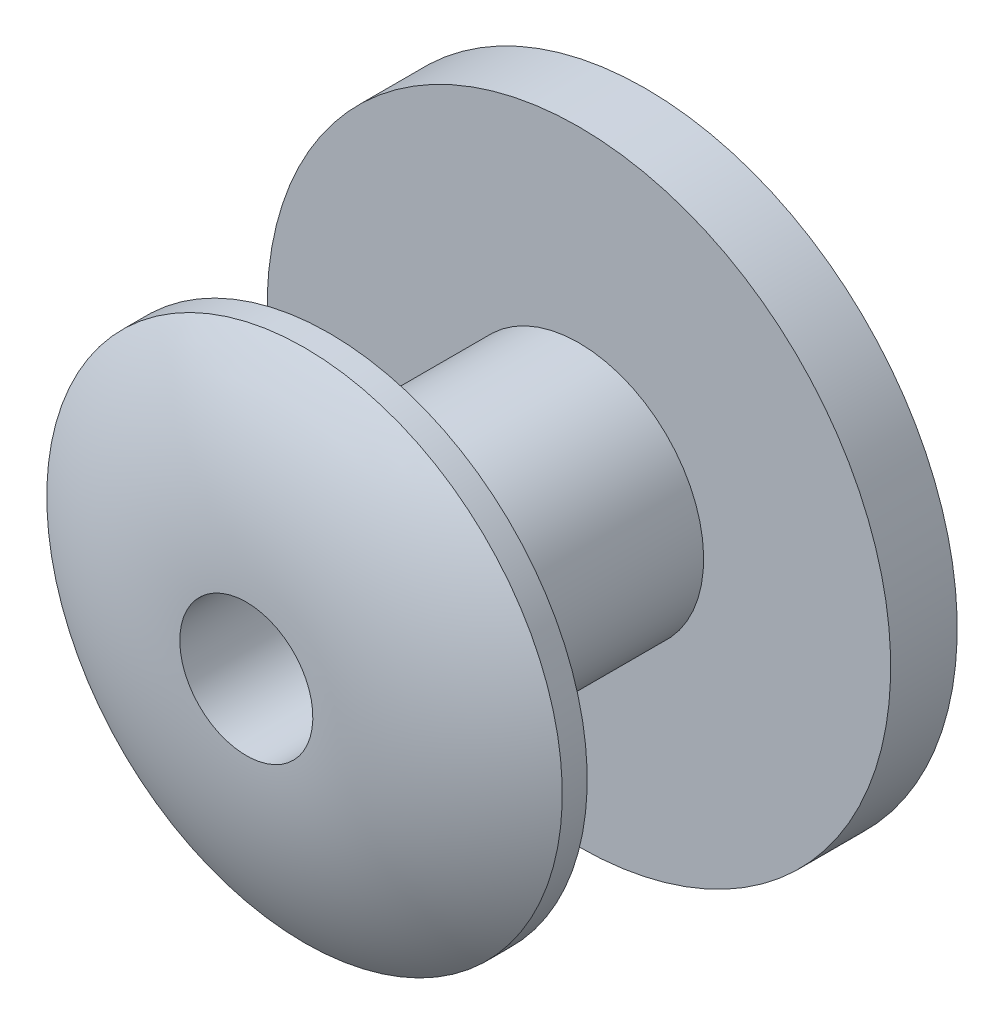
SolidWorks part; units mm, degrees
ref_plane "Front Plane" through (0, 0, 0) normal (0, 0, 1) x (1, 0, 0)
ref_plane "Top Plane" through (0, 0, 0) normal (0, 1, 0) x (1, 0, 0)
ref_plane "Right Plane" through (0, 0, 0) normal (1, 0, 0) x (0, 0, -1)
sketch "Sketch1" plane through (0, 0, 0) normal (1, 0, 0) x (0, 0, -1)
  line L0 (-3.8, 3.1) -> (-3.8, 1.5)
  line L1 (-3.8, 1.5) -> (-0.8, 1.5)
  line L2 (-0.8, 1.5) -> (-0.8, 3.75)
  line L3 (-0.8, 3.75) -> (0, 3.75)
  line L4 (0, 3.75) -> (0, 0.8)
  line L5 (0, 0.8) -> (-4.8, 0.8)
  line L6 (-3.8, 3.1) -> (-4.1, 3.1)
  line L7 (0, 0) -> (-4.8, 0) construction
  line L8 (-4.8, 0.8) -> (-4.8, 0) construction
  arc A0 (-4.1, 3.1) -> (-4.8, 0.8) centre (-0.6714, 0.8) ccw
  dimension "D1" = 6.2
  dimension "D2" = 1
  dimension "D3" = 0.3
  dimension "D4" = 3
  dimension "D5" = 1.6
  dimension "D6" = 3
  dimension "D7" = 0.8
  dimension "D8" = 7.5
revolve "Revolve1" add sketch "Sketch1" angle 360 about L7
